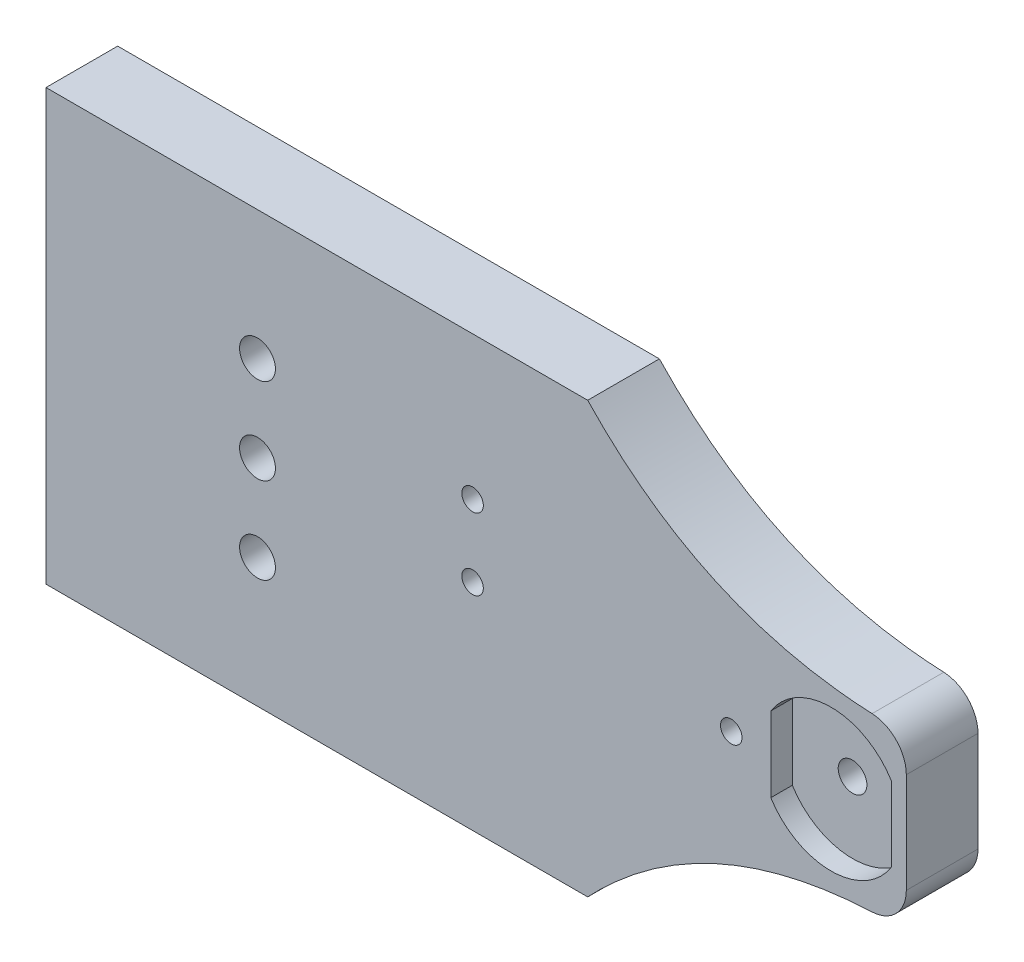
SolidWorks part; units mm, degrees
ref_plane "Plan de face" through (0, 0, 0) normal (0, 0, 1) x (1, 0, 0)
ref_plane "Plan de dessus" through (0, 0, 0) normal (0, 1, 0) x (1, 0, 0)
ref_plane "Plan de droite" through (0, 0, 0) normal (1, 0, 0) x (0, 0, -1)
sketch "Esquisse1" plane through (0, 0, 0) normal (0, 0, 1) x (1, 0, 0)
  line L1 (-95.5816, 31.9533) -> (24.4184, 31.9533)
  line L2 (-95.5816, 31.9533) -> (-95.5816, -28.0467)
  line L3 (-95.5816, -28.0467) -> (24.4184, -28.0467)
  line L4 (24.4184, 31.9533) -> (24.4184, -28.0467)
  dimension "D1" = 120
  dimension "D2" = 60
extrude "Boss.-Extru.1" add sketch "Esquisse1" along normal blind 10
sketch "Esquisse2" plane through (0, 0, 10) normal (0, 0, 1) x (1, 0, 0)
  line L0 (24.4184, 1.9533) -> (-95.5816, 1.9533) construction
  line L5 (-95.5816, 31.9533) -> (-95.5816, -28.0467) construction
  line L6 (24.4184, -28.0467) -> (24.4184, 31.9533) construction
  circle A0 centre (13.9184, 1.9533) radius 9.9
  dimension "D1" = 10.5
  dimension "D2" = 19.8
extrude "Enlèv. mat.-Extru.1" cut sketch "Esquisse2" against normal blind 3
sketch "Esquisse3" plane through (0, 0, 0) normal (0, 0, 1) x (1, 0, 0)
  line L0 (-95.5816, 1.9533) -> (-17.1998, 1.9533) construction
  line L1 (-95.5816, 31.9533) -> (-95.5816, -28.0467) construction
  line L2 (-66.0816, 1.7266) -> (-66.0816, 1.9533) construction
  line L6 (-66.0816, 13.9533) -> (-66.0816, 1.9533) construction
  line L8 (-66.0816, -10.0467) -> (-66.0816, 1.7266) construction
  line L9 (-36.0816, 1.9533) -> (-36.0816, 15.643) construction
  circle A0 centre (13.9184, 1.9533) radius 2
  circle A1 centre (-36.0816, 1.9533) radius 1.5
  circle A2 centre (-66.0816, 1.9533) radius 2.5
  circle A3 centre (-66.0816, 13.9533) radius 2.5
  circle A4 centre (-66.0816, -10.0467) radius 2.5
  circle A5 centre (-36.0816, 11.9533) radius 1.5
  dimension "D1" = 4
  dimension "D2" = 3
  dimension "D4" = 5
  dimension "D5" = 5
  dimension "D6" = 12
  dimension "D7" = 50
  dimension "D8" = 12
  dimension "D9" = 5
  dimension "D10" = 3
  dimension "D11" = 10
  dimension "D3" = 30
extrude "Enlèv. mat.-Extru.2" cut sketch "Esquisse3" against normal through all and the other way through all
sketch "Esquisse4" plane through (0, 0, 10) normal (0, 0, 1) x (1, 0, 0)
  line L0 (24.4184, 1.9533) -> (-95.5816, 1.9533) construction
  line L1 (24.4184, -28.0467) -> (24.4184, 31.9533) construction
  line L2 (-95.5816, 31.9533) -> (-95.5816, -28.0467) construction
  line L3 (22.3184, -8.869) -> (22.3184, 23.8603)
  line L12 (24.4184, 23.8603) -> (22.3184, 23.8603)
  line L13 (24.4184, -8.869) -> (22.3184, -8.869)
  line L14 (24.4184, -8.869) -> (24.4184, 23.8603)
  line L15 (13.9184, 11.8533) -> (13.9184, -7.9467) construction
  line L17 (5.5184, 20.9569) -> (-2.3665, 20.9569)
  line L18 (5.5184, 20.9569) -> (5.5184, -13.9813)
  line L19 (5.5184, -13.9813) -> (-2.3665, -13.9813)
  line L20 (-2.3665, 20.9569) -> (-2.3665, -13.9813)
  circle A0 centre (13.9184, 1.9533) radius 9.9 construction
  dimension "D1" = 8.4
  dimension "D2" = 8.4
extrude "Boss.-Extru.2" add sketch "Esquisse4" against normal blind 3
sketch "Esquisse5" plane through (0, 0, 10) normal (0, 0, 1) x (1, 0, 0)
  line L0 (24.4184, 1.9533) -> (-95.5816, 1.9533) construction
  line L1 (24.4184, -28.0467) -> (24.4184, 31.9533) construction
  line L2 (-95.5816, 31.9533) -> (-95.5816, -28.0467) construction
  line L3 (24.4184, 31.9533) -> (-95.5816, 31.9533) construction
  line L4 (-20.0231, 31.9533) -> (24.4184, 31.9533)
  line L5 (24.4184, 31.9533) -> (24.4184, 13.8772)
  line L6 (-20.0231, -28.0467) -> (24.4184, -28.0467)
  line L7 (24.4184, -28.0467) -> (24.4184, -9.9707)
  spline S0 degree 2 poles (24.4184, 13.8772) (-2.4454, 13.3232) (-20.0231, 31.9533) knots 0 0 0 1 1 1
  spline S1 degree 2 poles (24.4184, -9.9707) (-2.4454, -9.4167) (-20.0231, -28.0467) knots 0 0 0 1 1 1
extrude "Enlèv. mat.-Extru.3" cut sketch "Esquisse5" against normal blind 10
fillet "Congé1" radius 5 2 edges at (24.4184, 13.8772, 5) (24.4184, -9.9707, 5)
sketch "Esquisse6" plane through (0, 0, 10) normal (0, 0, 1) x (1, 0, 0)
  line L0 (-95.5816, 1.9533) -> (41.0467, 1.9533) construction
  line L1 (-95.5816, 31.9533) -> (-95.5816, -28.0467) construction
  circle A0 centre (0, 1.9533) radius 1.5
  dimension "D1" = 3
extrude "Enlèv. mat.-Extru.4" cut sketch "Esquisse6" against normal blind 10
